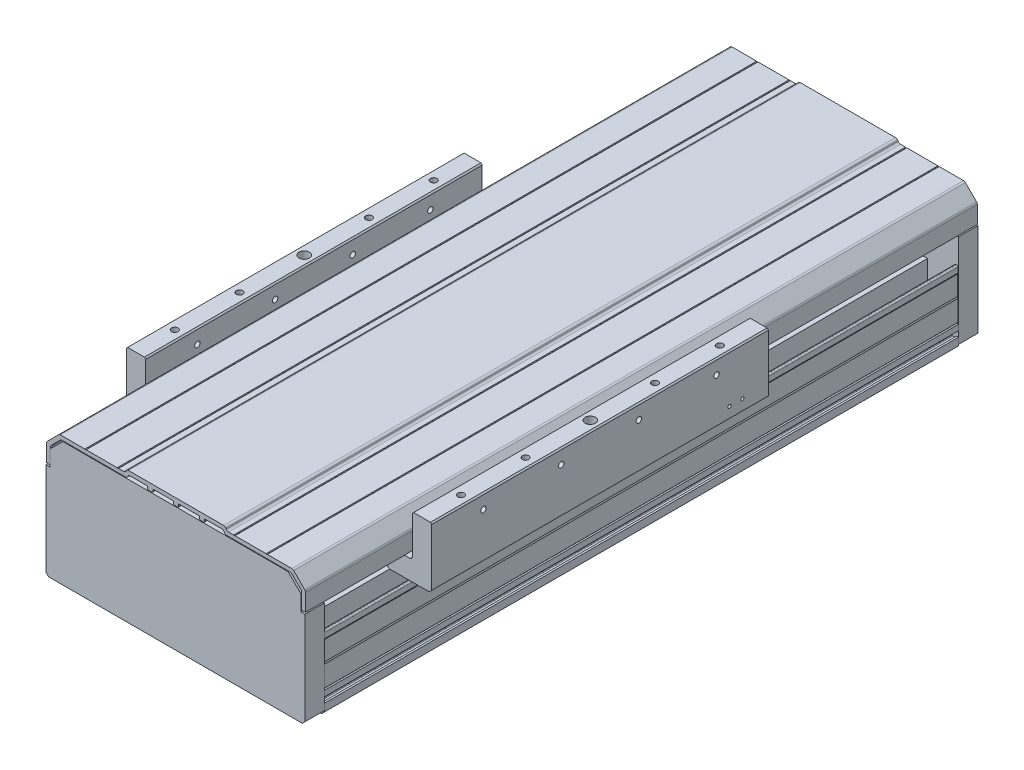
SolidWorks part; units mm, degrees
ref_plane "정면" through (0, 0, 0) normal (0, 0, 1) x (1, 0, 0)
ref_plane "윗면" through (0, 0, 0) normal (0, 1, 0) x (1, 0, 0)
ref_plane "우측면" through (0, 0, 0) normal (1, 0, 0) x (0, 0, -1)
sketch "스케치1" plane through (0, 0, 0) normal (0, 0, 1) x (1, 0, 0)
  line L0 (-99, 33.5) -> (-99, 48.5)
  line L1 (-97, 16.5) -> (-97, 53.5)
  line L2 (-99.5, 16.5) -> (-99.5, 32.5)
  line L3 (-97.5, 16) -> (-99, 16)
  line L4 (-99, 33.5) -> (-99.5, 32.5)
  line L5 (-98.5, 54.5) -> (-98, 54.5)
  line L6 (-99.5, 49.5) -> (-99.5, 53.5)
  line L7 (-99, 48.5) -> (-99.5, 49.5)
  line L8 (99, 33.5) -> (99, 48.5)
  line L9 (97, 16.5) -> (97, 53.5)
  line L10 (99.5, 16.5) -> (99.5, 32.5)
  line L11 (97.5, 16) -> (99, 16)
  line L12 (99, 33.5) -> (99.5, 32.5)
  line L13 (98.5, 54.5) -> (98, 54.5)
  line L14 (99.5, 49.5) -> (99.5, 53.5)
  line L15 (99, 48.5) -> (99.5, 49.5)
  line L16 (-78, 44.5) -> (-43.5, 44.5)
  line L17 (-36, -1) -> (-98, -1)
  line L18 (-66.55, 32.5) -> (-54.5, 32.5)
  line L19 (-100, 1) -> (-98, -1)
  line L20 (-78, 44.5) -> (-78, 37.5)
  line L21 (-69.5, 14.5) -> (-69.5, 30.0927)
  line L22 (-77.7, 37) -> (-78, 36.5)
  line L23 (-78, 37.5) -> (-77.7, 37)
  line L24 (-78, 26.5) -> (-77.1807, 25.0809)
  line L25 (-78, 36.5) -> (-78, 26.5)
  line L26 (-97, 21) -> (-97, 15.5)
  line L27 (-97, 25.5) -> (-97, 22)
  line L28 (-97, 15.5) -> (-100, 15.5)
  line L29 (36, -1) -> (98, -1)
  line L30 (35, 0) -> (-35, 0)
  line L31 (-35, 0) -> (-36, -1)
  line L32 (36, -1) -> (35, 0)
  line L33 (100, 1) -> (98, -1)
  line L34 (-16.9019, 9.5) -> (-14.3038, 11)
  line L35 (-14.3038, 5) -> (-16.9019, 6.5)
  line L36 (-22.5, 16) -> (22.5, 16)
  line L37 (-23, 16.5) -> (-22.5, 16)
  line L38 (-16.9019, 9.5) -> (-18.0629, 9.5)
  line L39 (-16.9019, 6.5) -> (-18.0629, 6.5)
  line L40 (-52.5, 30.5) -> (-52.5, 16.25)
  line L41 (-52, 15.75) -> (-51.4079, 15.75)
  line L42 (-51.6685, 12.5) -> (-67.5, 12.5)
  line L43 (-38.5, 16.5) -> (-23, 16.5)
  line L44 (22.5, 16) -> (23, 16.5)
  line L45 (23, 16.5) -> (38.5, 16.5)
  line L46 (16.9019, 9.5) -> (14.3038, 11)
  line L47 (14.3038, 5) -> (16.9019, 6.5)
  line L48 (16.9019, 9.5) -> (18.0629, 9.5)
  line L49 (16.9019, 6.5) -> (18.0629, 6.5)
  line L50 (-4, 9) -> (4, 9)
  line L51 (-7.3333, 11) -> (-4, 9)
  line L52 (7.3333, 11) -> (4, 9)
  line L53 (-14.3038, 11) -> (-7.3333, 11)
  line L54 (-14.3038, 5) -> (14.3038, 5)
  line L55 (7.3333, 11) -> (14.3038, 11)
  line L56 (43.5, 22.5) -> (43.5, 44.5)
  line L57 (97, 21) -> (97, 15.5)
  line L58 (97, 15.5) -> (100, 15.5)
  line L59 (97, 25.5) -> (97, 22)
  line L60 (95, 25.5) -> (97, 25.5)
  line L61 (95, 24) -> (95, 25.5)
  line L62 (71, 47.5) -> (71, 44.5)
  line L63 (71, 47.5) -> (76, 47.5)
  line L64 (71, 44.5) -> (43.5, 44.5)
  line L65 (100, 1) -> (100, 6.85)
  line L66 (98.5, 11.15) -> (100, 11.15)
  line L67 (98.5, 12.65) -> (98.5, 11.15)
  line L68 (95.5, 12.65) -> (98.5, 12.65)
  line L69 (95, 5.85) -> (95, 12.15)
  line L70 (98.5, 5.35) -> (95.5, 5.35)
  line L71 (98.5, 6.85) -> (98.5, 5.35)
  line L72 (100, 6.85) -> (98.5, 6.85)
  line L73 (100, 11.15) -> (100, 15.5)
  line L74 (-100, 1) -> (-100, 6.85)
  line L75 (-98.5, 11.15) -> (-100, 11.15)
  line L76 (-98.5, 12.65) -> (-98.5, 11.15)
  line L77 (-95.5, 12.65) -> (-98.5, 12.65)
  line L78 (-95, 5.85) -> (-95, 12.15)
  line L79 (-98.5, 5.35) -> (-95.5, 5.35)
  line L80 (-98.5, 6.85) -> (-98.5, 5.35)
  line L81 (-100, 6.85) -> (-98.5, 6.85)
  line L82 (-100, 11.15) -> (-100, 15.5)
  line L83 (38.5, 17.5) -> (38.5, 16.5)
  line L84 (-43.5, 22.5) -> (-43.5, 44.5)
  line L85 (-38.5, 17.5) -> (-38.5, 16.5)
  line L86 (80.8, 21) -> (79.5, 21)
  line L87 (79.5, 18) -> (93.5, 18)
  line L88 (79.5, 21) -> (79.5, 18)
  line L89 (92, 21.2) -> (92, 22.8)
  line L90 (92.2, 21) -> (92, 21.2)
  line L91 (93.5, 21) -> (92.2, 21)
  line L92 (92.2, 23) -> (94, 23)
  line L93 (92, 22.8) -> (92.2, 23)
  line L94 (93.5, 18) -> (93.5, 21)
  line L95 (81, 22.8) -> (81, 21.2)
  line L96 (81, 21.2) -> (80.8, 21)
  line L97 (80.8, 23) -> (81, 22.8)
  line L98 (78.4, 23) -> (80.8, 23)
  line L99 (-95, 25.5) -> (-97, 25.5)
  line L100 (-95, 24) -> (-95, 25.5)
  line L101 (-80.8, 21) -> (-79.5, 21)
  line L102 (-79.5, 18) -> (-93.5, 18)
  line L103 (-79.5, 21) -> (-79.5, 18)
  line L104 (-92, 21.2) -> (-92, 22.8)
  line L105 (-92.2, 21) -> (-92, 21.2)
  line L106 (-93.5, 21) -> (-92.2, 21)
  line L107 (-92.2, 23) -> (-94, 23)
  line L108 (-92, 22.8) -> (-92.2, 23)
  line L109 (-93.5, 18) -> (-93.5, 21)
  line L110 (-81, 22.8) -> (-81, 21.2)
  line L111 (-81, 21.2) -> (-80.8, 21)
  line L112 (-80.8, 23) -> (-81, 22.8)
  line L113 (-78.4, 23) -> (-80.8, 23)
  line L114 (76, 47.5) -> (76, 31.4999)
  line L115 (76, 31.4999) -> (76.3, 31.4999)
  line L116 (76.3, 31.4999) -> (76.3, 24.581)
  line L117 (-97, 22) -> (-96.7, 21.5)
  line L118 (-96.7, 21.5) -> (-97, 21)
  line L119 (97, 22) -> (96.7, 21.5)
  line L120 (96.7, 21.5) -> (97, 21)
  line L121 (66.55, 32.5) -> (54.5, 32.5)
  line L122 (69.5, 14.5) -> (69.5, 30.0927)
  line L123 (52.5, 30.5) -> (52.5, 16.25)
  line L124 (52, 15.75) -> (51.4079, 15.75)
  line L125 (51.6685, 12.5) -> (67.5, 12.5)
  arc A0 (-99.5, 16.5) -> (-99, 16) centre (-99, 16.5) ccw
  arc A1 (-97.5, 16) -> (-97, 16.5) centre (-97.5, 16.5) ccw
  arc A2 (-98.5, 54.5) -> (-99.5, 53.5) centre (-98.5, 53.5) ccw
  arc A3 (-97, 53.5) -> (-98, 54.5) centre (-98, 53.5) ccw
  arc A4 (99, 16) -> (99.5, 16.5) centre (99, 16.5) ccw
  arc A5 (97, 16.5) -> (97.5, 16) centre (97.5, 16.5) ccw
  arc A6 (99.5, 53.5) -> (98.5, 54.5) centre (98.5, 53.5) ccw
  arc A7 (98, 54.5) -> (97, 53.5) centre (98, 53.5) ccw
  arc A8 (-69.5, 14.5) -> (-67.5, 12.5) centre (-67.5, 14.5) ccw
  arc A9 (-77.4769, 22.3846) -> (-76.1936, 24.5882) centre (-76, 23) ccw
  arc A10 (-77.4769, 22.3846) -> (-78.4, 23) centre (-78.4, 22) ccw
  arc A11 (-67.05, 33) -> (-66.55, 32.5) centre (-66.55, 33) ccw
  arc A12 (-77.1807, 25.0809) -> (-76.1936, 24.5882) centre (-76.3147, 25.5809) ccw
  arc A13 (-69.5, 30.0927) -> (-69.9153, 30.5854) centre (-70, 30.0927) ccw
  arc A14 (-18.0629, 9.5) -> (-18.0629, 6.5) centre (-20, 8) ccw
  arc A15 (-52.5, 16.25) -> (-52, 15.75) centre (-52, 16.25) ccw
  arc A16 (-51.4079, 15.75) -> (-51.0845, 15.8686) centre (-51.4079, 16.25) ccw
  arc A17 (-51.301, 12.339) -> (-51.0845, 15.8686) centre (-49.5, 14) ccw
  arc A18 (-51.301, 12.339) -> (-51.6685, 12.5) centre (-51.6685, 12) ccw
  arc A19 (-52.5, 30.5) -> (-54.5, 32.5) centre (-54.5, 30.5) ccw
  arc A20 (18.0629, 6.5) -> (18.0629, 9.5) centre (20, 8) ccw
  arc A21 (38.5, 17.5) -> (43.5, 22.5) centre (38.5, 22.5) ccw
  arc A22 (78.4, 23) -> (77.4769, 22.3846) centre (78.4, 22) ccw
  arc A23 (94, 23) -> (95, 24) centre (94, 24) ccw
  arc A24 (95.5, 12.65) -> (95, 12.15) centre (95.5, 12.15) ccw
  arc A25 (95, 5.85) -> (95.5, 5.35) centre (95.5, 5.85) ccw
  arc A26 (-95, 12.15) -> (-95.5, 12.65) centre (-95.5, 12.15) ccw
  arc A27 (-95.5, 5.35) -> (-95, 5.85) centre (-95.5, 5.85) ccw
  arc A28 (-43.5, 22.5) -> (-38.5, 17.5) centre (-38.5, 22.5) ccw
  arc A29 (-67.05, 33) -> (-69.9153, 30.5854) centre (-69.5, 33) ccw
  arc A30 (-95, 24) -> (-94, 23) centre (-94, 24) ccw
  arc A31 (76.1936, 24.5882) -> (77.4769, 22.3846) centre (76, 23) ccw
  arc A32 (76.1936, 24.5882) -> (76.3, 24.581) centre (76.3147, 25.5809) ccw
  arc A33 (67.5, 12.5) -> (69.5, 14.5) centre (67.5, 14.5) ccw
  arc A34 (66.55, 32.5) -> (67.05, 33) centre (66.55, 33) ccw
  arc A35 (69.9153, 30.5854) -> (69.5, 30.0927) centre (70, 30.0927) ccw
  arc A36 (52, 15.75) -> (52.5, 16.25) centre (52, 16.25) ccw
  arc A37 (51.0845, 15.8686) -> (51.4079, 15.75) centre (51.4079, 16.25) ccw
  arc A38 (51.0845, 15.8686) -> (51.301, 12.339) centre (49.5, 14) ccw
  arc A39 (51.6685, 12.5) -> (51.301, 12.339) centre (51.6685, 12) ccw
  arc A40 (54.5, 32.5) -> (52.5, 30.5) centre (54.5, 30.5) ccw
  arc A41 (69.9153, 30.5854) -> (67.05, 33) centre (69.5, 33) ccw
extrude "보스-돌출1" add sketch "스케치1" along normal mid plane 490 contours A31 A32 L116 L115 L114 L63 L62 L64 L56 A21 L83 L45 L44 L36 L37 L43 L85 A28 L84 L16 L20 L23 L22 L25 L24 A12 A9 A10 L113 L112 L110 L111 L101 L103 L102 L109 L106 L105 L104 L108 L107 A30 L100 L99 L1 L117 L118 L26 L28 L82 | L9 A7 L13 A6 L14 L15 L8 L12 L10 A4 L11 A5
sketch "스케치2" plane through (0, 0, 245) normal (0, 0, 1) x (1, 0, 0)
  line L0 (97, 86) -> (87, 96)
  line L1 (-98, 0) -> (98, 0)
  line L2 (-87, 96) -> (87, 96)
  line L3 (-100, 74) -> (-100, 2)
  line L4 (-100, 2) -> (-98, 0)
  line L5 (-97, 86) -> (-87, 96)
  line L6 (-97, 86) -> (-97, 74)
  line L7 (-100, 74) -> (-97, 74)
  line L8 (100, 74) -> (100, 2)
  line L9 (100, 2) -> (98, 0)
  line L10 (97, 86) -> (97, 74)
  line L11 (97, 74) -> (100, 74)
extrude "보스-돌출2" add sketch "스케치2" along normal blind 15 separate body
sketch "스케치3" plane through (0, 0, -245) normal (0, 0, -1) x (-1, 0, 0)
  line L0 (97, 86) -> (87, 96)
  line L1 (-98, 0) -> (98, 0)
  line L2 (-87, 96) -> (87, 96)
  line L3 (-100, 74) -> (-100, 2)
  line L4 (-100, 2) -> (-98, 0)
  line L5 (-97, 86) -> (-87, 96)
  line L6 (-97, 86) -> (-97, 74)
  line L7 (-100, 74) -> (-97, 74)
  line L8 (100, 74) -> (100, 2)
  line L9 (100, 2) -> (98, 0)
  line L10 (97, 86) -> (97, 74)
  line L11 (97, 74) -> (100, 74)
extrude "보스-돌출3" add sketch "스케치3" along normal blind 15 separate body
ref_plane "평면1" through (0, 0, 180) normal (0, 0, 1) x (1, 0, 0)
sketch "스케치4" plane through (0, 0, 180) normal (0, 0, 1) x (1, 0, 0)
  line L0 (0, 0) -> (0, 72.5) construction
  line L1 (35, 0) -> (-35, 0) construction
  line L2 (104, 104) -> (103, 103)
  line L3 (103, 103) -> (103, 74)
  line L4 (101, 72) -> (96, 72)
  line L5 (94, 74) -> (94, 77.5)
  line L6 (84, 87.5) -> (58.5, 87.5)
  line L7 (58.5, 87.5) -> (56.5, 89.5)
  line L8 (56.5, 89.5) -> (-56.5, 89.5)
  line L9 (-56.5, 89.5) -> (-58.5, 87.5)
  line L10 (-58.5, 87.5) -> (-84, 87.5)
  line L11 (-94, 77.5) -> (-94, 74)
  line L12 (-96, 72) -> (-101, 72)
  line L13 (-103, 74) -> (-103, 103)
  line L14 (-103, 103) -> (-104, 104)
  line L15 (83, 72.5) -> (-83, 72.5)
  line L16 (-118, 59) -> (-118, 103)
  line L17 (-118, 59) -> (-118, 103)
  line L18 (-116, 57) -> (-85, 57)
  line L19 (-118, 59) -> (-116, 57)
  line L20 (-85, 57) -> (-83, 59)
  line L21 (-83, 59) -> (-83, 72.5)
  line L22 (-117, 104) -> (-104, 104)
  line L23 (-117, 104) -> (-118, 103)
  line L26 (83, 72.5) -> (83, 59)
  line L27 (84, 87.5) -> (58.5, 87.5)
  line L28 (118, 59) -> (118, 103)
  line L29 (85, 57) -> (116, 57)
  line L30 (116, 57) -> (118, 59)
  line L31 (117, 104) -> (104, 104)
  line L32 (118, 103) -> (117, 104)
  line L33 (81.75, 87.5) -> (84, 87.5)
  line L34 (83, 59) -> (85, 57)
  arc A0 (101, 72) -> (103, 74) centre (101, 74) ccw
  arc A1 (94, 74) -> (96, 72) centre (96, 74) ccw
  arc A2 (94, 77.5) -> (84, 87.5) centre (84, 77.5) ccw
  arc A3 (-84, 87.5) -> (-94, 77.5) centre (-84, 77.5) ccw
  arc A4 (-96, 72) -> (-94, 74) centre (-96, 74) ccw
  arc A5 (-103, 74) -> (-101, 72) centre (-101, 74) ccw
  dimension "D1" = 72.5
extrude "보스-돌출4" add sketch "스케치4" against normal blind 260 separate body contours A5 L13 L14 L22 L23 L16 L19 L18 L20 L21 L15 L26 L34 L29 L30 L28 L32 L31 L2 L3 A0 L4 A1 L5 A2 L6 L27 L7 L8 L9 L10 A3 L11 A4 L12
sketch "스케치5" plane through (0, 0, 0) normal (0, 0, 1) x (1, 0, 0)
  line L0 (0, 0) -> (0, 101.5) construction
  line L1 (-98, 0) -> (98, 0) construction
  line L2 (36.7494, 101.5) -> (-36.7494, 101.5)
  line L3 (-45.5, 99) -> (-69.5, 99)
  line L4 (-88.1265, 96) -> (-39.2151, 96)
  line L5 (-90.7833, 98.4142) -> (-99.4142, 89.7833)
  line L6 (-96.4142, 88.5407) -> (-89.5407, 95.4142)
  line L7 (-100, 75) -> (-97, 75)
  line L8 (-97, 75) -> (-97, 87.1265)
  line L9 (-100, 88.3691) -> (-100, 75)
  line L10 (-70.5, 99) -> (-89.3691, 99)
  line L11 (-70, 98.7) -> (-70.5, 99)
  line L12 (-69.5, 99) -> (-70, 98.7)
  line L13 (-37.518, 96.9417) -> (-37.1335, 97.5583)
  line L14 (-40.528, 99) -> (-44.5, 99)
  line L15 (-45, 98.7) -> (-45.5, 99)
  line L16 (-44.5, 99) -> (-45, 98.7)
  line L17 (-38.4465, 100.5583) -> (-38.831, 99.9417)
  line L18 (2.25, 98.5) -> (17.75, 98.5)
  line L19 (-18, 96.75) -> (-18, 98.25)
  line L20 (-22, 98.25) -> (-22, 96.75)
  line L21 (-21.25, 96) -> (-18.75, 96)
  line L22 (2, 96.75) -> (2, 98.25)
  line L23 (-1.25, 96) -> (1.25, 96)
  line L24 (-2, 98.25) -> (-2, 96.75)
  line L25 (-17.75, 98.5) -> (-2.25, 98.5)
  line L26 (-35.4364, 98.5) -> (-22.25, 98.5)
  line L27 (22, 96.75) -> (22, 98.25)
  line L28 (18.75, 96) -> (21.25, 96)
  line L29 (18, 98.25) -> (18, 96.75)
  line L30 (22.25, 98.5) -> (35.4364, 98.5)
  line L31 (89.3691, 99) -> (70.5, 99)
  line L32 (39.2151, 96) -> (88.1265, 96)
  line L33 (37.1335, 97.5583) -> (37.518, 96.9417)
  line L34 (69.5, 99) -> (45.5, 99)
  line L35 (38.831, 99.9417) -> (38.4465, 100.5583)
  line L36 (44.5, 99) -> (40.528, 99)
  line L37 (45, 98.7) -> (44.5, 99)
  line L38 (45.5, 99) -> (45, 98.7)
  line L39 (70, 98.7) -> (69.5, 99)
  line L40 (70.5, 99) -> (70, 98.7)
  line L41 (99.4142, 89.7833) -> (90.7833, 98.4142)
  line L42 (97, 75) -> (100, 75)
  line L43 (89.5407, 95.4142) -> (96.4142, 88.5407)
  line L44 (97, 87.1265) -> (97, 75)
  line L45 (100, 75) -> (100, 88.3691)
  arc A0 (-88.1265, 96) -> (-89.5407, 95.4142) centre (-88.1265, 94) ccw
  arc A1 (-96.4142, 88.5407) -> (-97, 87.1265) centre (-95, 87.1265) ccw
  arc A2 (-99.4142, 89.7833) -> (-100, 88.3691) centre (-98, 88.3691) ccw
  arc A3 (-89.3691, 99) -> (-90.7833, 98.4142) centre (-89.3691, 97) ccw
  arc A4 (-35.4364, 98.5) -> (-37.1335, 97.5583) centre (-35.4364, 96.5) ccw
  arc A5 (-39.2151, 96) -> (-37.518, 96.9417) centre (-39.2151, 98) ccw
  arc A6 (-36.7494, 101.5) -> (-38.4465, 100.5583) centre (-36.7494, 99.5) ccw
  arc A7 (-40.528, 99) -> (-38.831, 99.9417) centre (-40.528, 101) ccw
  arc A8 (2.25, 98.5) -> (2, 98.25) centre (2.25, 98.25) ccw
  arc A9 (-2, 98.25) -> (-2.25, 98.5) centre (-2.25, 98.25) ccw
  arc A10 (-17.75, 98.5) -> (-18, 98.25) centre (-17.75, 98.25) ccw
  arc A11 (-22, 98.25) -> (-22.25, 98.5) centre (-22.25, 98.25) ccw
  arc A12 (-18.75, 96) -> (-18, 96.75) centre (-18.75, 96.75) ccw
  arc A13 (-22, 96.75) -> (-21.25, 96) centre (-21.25, 96.75) ccw
  arc A14 (1.25, 96) -> (2, 96.75) centre (1.25, 96.75) ccw
  arc A15 (-2, 96.75) -> (-1.25, 96) centre (-1.25, 96.75) ccw
  arc A16 (22.25, 98.5) -> (22, 98.25) centre (22.25, 98.25) ccw
  arc A17 (18, 98.25) -> (17.75, 98.5) centre (17.75, 98.25) ccw
  arc A18 (21.25, 96) -> (22, 96.75) centre (21.25, 96.75) ccw
  arc A19 (18, 96.75) -> (18.75, 96) centre (18.75, 96.75) ccw
  arc A20 (37.1335, 97.5583) -> (35.4364, 98.5) centre (35.4364, 96.5) ccw
  arc A21 (37.518, 96.9417) -> (39.2151, 96) centre (39.2151, 98) ccw
  arc A22 (38.4465, 100.5583) -> (36.7494, 101.5) centre (36.7494, 99.5) ccw
  arc A23 (38.831, 99.9417) -> (40.528, 99) centre (40.528, 101) ccw
  arc A24 (89.5407, 95.4142) -> (88.1265, 96) centre (88.1265, 94) ccw
  arc A25 (97, 87.1265) -> (96.4142, 88.5407) centre (95, 87.1265) ccw
  arc A26 (100, 88.3691) -> (99.4142, 89.7833) centre (98, 88.3691) ccw
  arc A27 (90.7833, 98.4142) -> (89.3691, 99) centre (89.3691, 97) ccw
  dimension "D1" = 101.5
extrude "보스-돌출5" add sketch "스케치5" along normal mid plane 519 separate body
hole_wizard "M8 육각 머리 볼트용 카운터보어1" positions "스케치8" profile "스케치7" counterbore size "M8" standard "ISO"
sketch "스케치8" plane through (0, 18, 0) normal (0, 1, 0) x (-1, 0, 0)
  line L0 (-35, 245) -> (35, 245) construction
  line L1 (-36, 245) -> (-98, 245) construction
  point P0 (86.5, 120)
  point P1 (-86.5, 120)
  point P8 (0, 245)
  dimension "D1" = 173
  dimension "D2" = 86.5
  dimension "D3" = 125
sketch "스케치7" plane through (-86.5, 18, 120) normal (1, 0, 0) x (0, 0, 1)
  line L0 (0, 0) -> (0, 19)
  line L1 (0, 19) -> (4.5, 19)
  line L3 (4.5, 19) -> (4.5, 9)
  line L4 (4.5, 9) -> (7, 9)
  line L5 (7, 9) -> (7, 0)
  line L7 (7, 0) -> (0, 0)
  line L11 (0, -6.35) -> (0, 107.95) construction
  dimension "관통 구멍 지름" = 9
  dimension "관통 구멍 깊이" = 19
  dimension "카운터보어 지름" = 14
  dimension "카운터보어 깊이" = 9
pattern_linear "선형 패턴1" count 2 spacing 240 along (0, 0, -1) of "M8 육각 머리 볼트용 카운터보어1"
hole_wizard "M6 나사 구멍1" positions "스케치10" profile "스케치9" tap size "M6" standard "ISO"
sketch "스케치10" plane through (0, 104, 0) normal (0, 1, 0) x (-1, 0, 0)
  line L0 (-118, -80) -> (-118, 180) construction
  line L1 (-117, 180) -> (-104, 180) construction
  point P0 (-110.5, 150)
  point P1 (-110.5, 100)
  point P3 (-110.5, 0)
  point P5 (-110.5, -50)
  dimension "D1" = 7.5
  dimension "D2" = 30
  dimension "D3" = 50
  dimension "D4" = 100
  dimension "D5" = 50
sketch "스케치9" plane through (110.5, 104, 150) normal (1, 0, 0) x (0, 0, 1)
  line L0 (0, 0) -> (0, 24.5022)
  line L1 (0, 24.5022) -> (2.5, 23)
  line L2 (2.5, 23) -> (2.5, 0)
  line L5 (2.5, 0) -> (0, 0)
  line L10 (0, 24.5022) -> (-2.5, 23) construction
  line L11 (0, -6.35) -> (0, 107.95) construction
  dimension "탭 드릴 지름" = 5
  dimension "탭 드릴 깊이" = 23
  dimension "드릴 각도" = 118
hole_wizard "M5 나사 구멍1" positions "스케치12" profile "스케치11" tap size "M5" standard "ISO"
sketch "스케치12" plane through (118, 0, 0) normal (1, 0, 0) x (0, 0, -1)
  line L0 (80, 104) -> (-180, 104) construction
  line L1 (-180, 59) -> (-180, 103) construction
  point P0 (-140, 93)
  point P1 (-80, 93)
  point P3 (-20, 93)
  point P5 (40, 93)
  dimension "D1" = 11
  dimension "D2" = 40
  dimension "D3" = 60
  dimension "D4" = 60
  dimension "D5" = 60
sketch "스케치11" plane through (118, 93, 140) normal (0, 1, 0) x (0, 0, -1)
  line L0 (0, 0) -> (0, 17.2618)
  line L1 (0, 17.2618) -> (2.1, 16)
  line L2 (2.1, 16) -> (2.1, 0)
  line L5 (2.1, 0) -> (0, 0)
  line L10 (0, 17.2618) -> (-2.1, 16) construction
  line L11 (0, -6.35) -> (0, 107.95) construction
  dimension "탭 드릴 지름" = 4.2
  dimension "탭 드릴 깊이" = 16
  dimension "드릴 각도" = 118
sketch "스케치14" plane through (0, 104, 0) normal (0, 1, 0) x (-1, 0, 0)
  line L0 (-118, -80) -> (-118, 180) construction
  line L1 (-117, -80) -> (-104, -80) construction
  circle A0 centre (-110.5, 50) radius 2.5
  dimension "D2" = 5
  dimension "D1" = 7.5
  dimension "D3" = 130
extrude "컷-돌출1" cut sketch "스케치14" against normal up to next (47 mm away)
sketch "스케치15" plane through (0, 104, 0) normal (0, 1, 0) x (1, 0, 0)
  circle A0 centre (110.5, -50) radius 4
  dimension "D1" = 8
extrude "컷-돌출2" cut sketch "스케치15" against normal blind 18
mirror "대칭 복사1" about plane through (0, 0, 0) normal (1, 0, 0) of "컷-돌출2", "컷-돌출1", "M5 나사 구멍1", "M6 나사 구멍1"
hole_wizard "M3 나사 구멍1" positions "스케치17" profile "스케치16" tap size "M3" standard "ISO"
sketch "스케치17" plane through (118, 0, 0) normal (1, 0, 0) x (0, 0, -1)
  line L0 (80, 59) -> (80, 103) construction
  line L1 (80, 57) -> (-180, 57) construction
  point P0 (60, 67)
  point P1 (50, 67)
  dimension "D1" = 20
  dimension "D2" = 10
  dimension "D3" = 10
sketch "스케치16" plane through (118, 67, -60) normal (0, 1, 0) x (0, 0, -1)
  line L0 (0, 0) -> (0, 13.2511)
  line L1 (0, 13.2511) -> (1.25, 12.5)
  line L2 (1.25, 12.5) -> (1.25, 0)
  line L5 (1.25, 0) -> (0, 0)
  line L10 (0, 13.2511) -> (-1.25, 12.5) construction
  line L11 (0, -6.35) -> (0, 107.95) construction
  dimension "탭 드릴 지름" = 2.5
  dimension "탭 드릴 깊이" = 12.5
  dimension "드릴 각도" = 118
mirror "대칭 복사2" about plane through (0, 0, 0) normal (1, 0, 0) of "M3 나사 구멍1"
